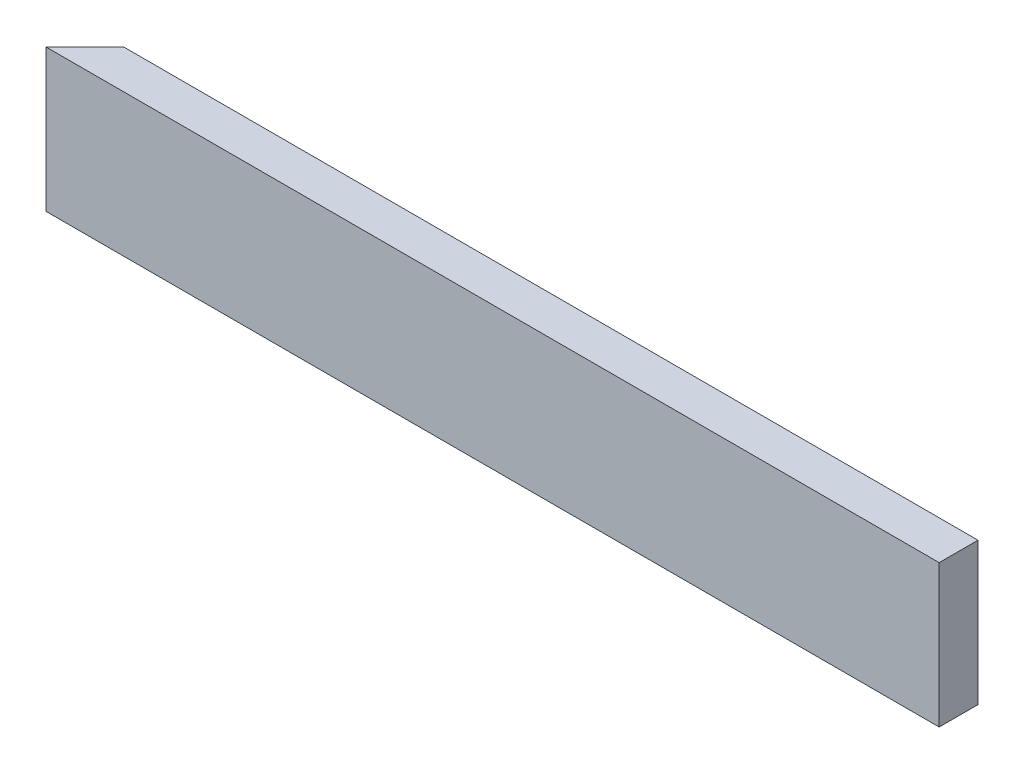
SolidWorks part; units mm, degrees
ref_plane "Front Plane" through (0, 0, 0) normal (0, 0, 1) x (1, 0, 0)
ref_plane "Top Plane" through (0, 0, 0) normal (0, 1, 0) x (1, 0, 0)
ref_plane "Right Plane" through (0, 0, 0) normal (1, 0, 0) x (0, 0, -1)
sketch "Sketch2" plane through (0, 0, 0) normal (0, 1, 0) x (1, 0, 0)
  line L0 (0, 0) -> (0, -38.1)
  line L1 (0, -38.1) -> (-876.3, -38.1)
  line L2 (-876.3, -38.1) -> (-838.2, 0)
  line L3 (-838.2, 0) -> (0, 0)
extrude "Boss-Extrude1" add sketch "Sketch2" along normal blind 139.7
equation "\"system_width\"= 7ft + 10 "
equation "\"system_length\"= 95.5"
equation "\"module_board_length\"= 11.25in"
equation "\"module_board_width\"= 1.5in"
equation "\"step_board_length\"= 5.5in"
equation "\"step_board_width\"= 1.5in"
equation "\"module_lip_width\"= 1.5in"
equation "\"module_trim_thickness\"= 1in"
equation "\"module_width\"= (\"system_width\" -  2* \"module_trim_thickness\") / 2"
equation "\"module_board_short_depth\"= \"module_width\" - ( 2 * \"module_board_width\" ) - \"module_lip_width\""
equation "\"module_board_hole\"= 0.5in"
equation "\"module_board_hole_seperation\"= 20in"
equation "\"system_step_length\"= 2ft+11.5"
equation "\"system_top_length\"= \"system_length\" - \"system_step_length\""
equation "\"module_top_thickness\"= 0.75in"
equation "\"module_trim_height\"= 14in"
equation "\"module_top_overhang\"= 4.5in"
equation "\"module_trim_angle\"= 45deg"
equation "\"module_length\"= (\"system_top_length\" - \"module_trim_thickness\")/ 2"
equation "\"module_board_long_depth\"= \"module_length\" - \"module_lip_width\""
equation "\"module_board_hole_position\"= ( ( \"module_width\" - \"module_board_hole_seperation\" ) / 2 ) + \"module_board_width\"/2"
equation "\"step_module_width\"= \"module_width\""
equation "\"step_module_length\"= \"system_step_length\" - \"module_trim_thickness\""
equation "\"step_board_short_depth\"= \"step_module_length\" - \"module_lip_width\""
equation "\"step_board_long_depth\"= \"step_module_width\" - (2 * \"module_board_width\") - \"module_lip_width\""
equation "\"D1@Sketch2\"=\"step_module_length\""
equation "\"D2@Sketch2\"=\"step_board_width\""
equation "\"D3@Sketch2\"=\"module_trim_angle\""
equation "\"D1@Boss-Extrude1\"=\"step_board_length\""
